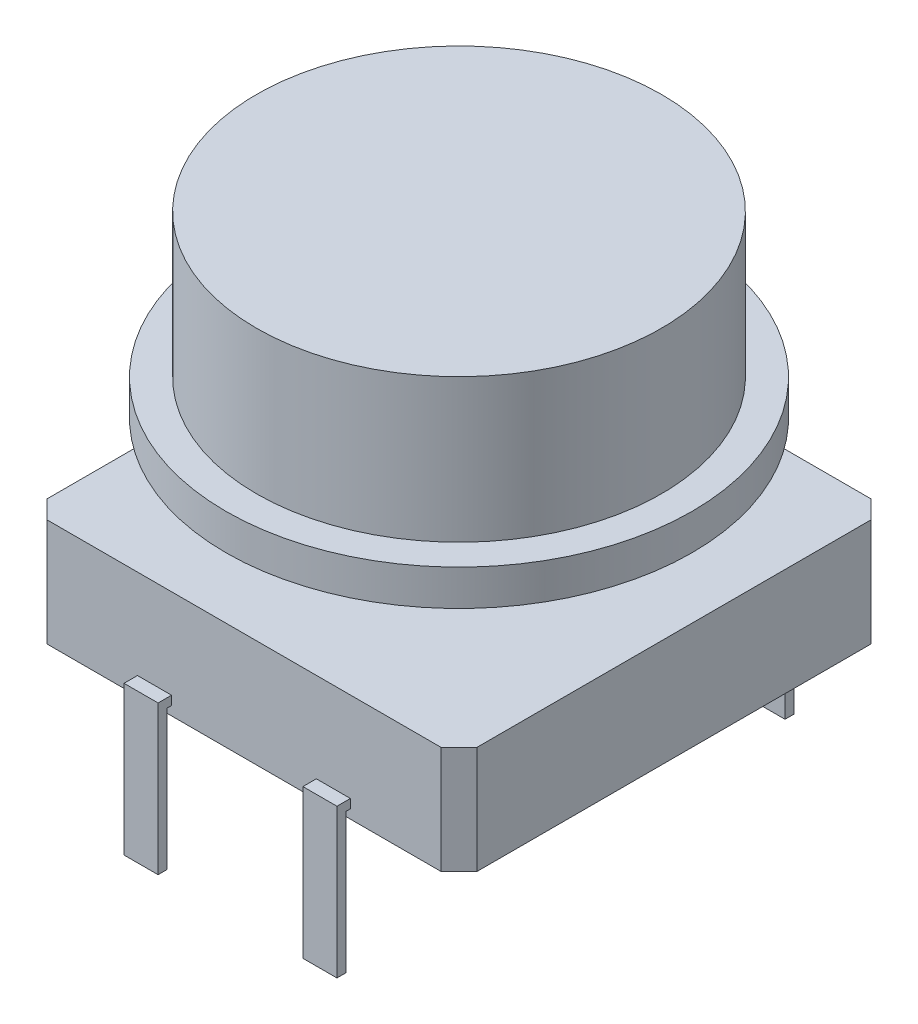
SolidWorks part; units mm, degrees
other "Markup1"
sketch "Sketch13" plane through (-6.5, 10.2, -6.5) normal (-0.9979, 0.0018, -0.0647) x (-0.0647, 0.0089, 0.9979)
ref_plane "Front Plane" through (0, 0, 0) normal (0, 0, 1) x (1, 0, 0)
ref_plane "Top Plane" through (0, 0, 0) normal (0, 1, 0) x (1, 0, 0)
ref_plane "Right Plane" through (0, 0, 0) normal (1, 0, 0) x (0, 0, -1)
sketch "Sketch1" plane through (0, 0, 0) normal (0, 1, 0) x (1, 0, 0)
  line L0 (-5.5, 6) -> (-6, 5.5)
  line L1 (-5.5, 6) -> (5.5, 6)
  line L2 (-6, 5.5) -> (-6, -5.5)
  line L3 (-5.5, -6) -> (5.5, -6)
  line L4 (6, 5.5) -> (6, -5.5)
  line L5 (-6, 6) -> (6, -6) construction
  line L6 (-6, -6) -> (6, 6) construction
  line L7 (5.5, 6) -> (6, 5.5)
  line L8 (5.5, -6) -> (6, -5.5)
  line L9 (-6, -5.5) -> (-5.5, -6)
  point P0 (0, 0)
  dimension "D1" = 12
  dimension "D2" = 12
extrude "Boss-Extrude1" add sketch "Sketch1" along normal blind 3
sketch "Sketch2" plane through (0, 3, 0) normal (0, 1, 0) x (1, 0, 0)
  circle A0 centre (0, 0) radius 3.375
  dimension "D1" = 6.75
extrude "Boss-Extrude2" add sketch "Sketch2" along normal blind 0.2
sketch "Sketch3" plane through (0, 3.2, 0) normal (0, 1, 0) x (1, 0, 0)
  line L1 (-1.75, 1.75) -> (1.75, 1.75)
  line L2 (-1.75, 1.75) -> (-1.75, -1.75)
  line L3 (-1.75, -1.75) -> (1.75, -1.75)
  line L4 (1.75, 1.75) -> (1.75, -1.75)
  line L5 (-1.75, 1.75) -> (1.75, -1.75) construction
  line L6 (-1.75, -1.75) -> (1.75, 1.75) construction
  point P0 (0, 0)
  dimension "D1" = 3.5
  dimension "D2" = 3.5
extrude "Boss-Extrude3" add sketch "Sketch3" along normal blind 2
sketch "Sketch4" plane through (0, 5.2, 0) normal (0, 1, 0) x (1, 0, 0)
  circle A0 centre (0, 0) radius 6.5
  dimension "D1" = 13
extrude "Boss-Extrude4" add sketch "Sketch4" along normal blind 1
sketch "Sketch5" plane through (0, 6.2, 0) normal (0, 1, 0) x (1, 0, 0)
  circle A0 centre (0, 0) radius 5.65
  dimension "D1" = 11.3
extrude "Boss-Extrude5" add sketch "Sketch5" along normal blind 4
ref_plane "Plane1" through (-2.97, 0, 0) normal (-1, 0, 0) x (0, 0, 1)
sketch "Sketch7" plane through (-2.97, 0, 0) normal (-1, 0, 0) x (0, 0, 1)
  line L1 (6, 3) -> (6, 0) construction
  line L7 (6.375, 0.5) -> (6, 0.5)
  line L9 (-5.5, 3) -> (5.5, 3) construction
  line L17 (0, -2.34) -> (0, 11.1182) construction
  line L18 (6, 0.5) -> (6, 0.25)
  line L23 (6.1875, 0.5) -> (6.1875, -2.75) construction
  line L24 (6, 0.25) -> (6.125, 0.25)
  line L28 (6.125, 0.25) -> (6.125, -3.65)
  line L29 (6.375, 0.5) -> (6.375, -3.65)
  line L30 (6.375, -3.65) -> (6.125, -3.65)
  dimension "D1" = 2.5
  dimension "D2" = 0.375
  dimension "D6" = 0.25
extrude "Boss-Extrude6" add sketch "Sketch7" against normal blind 0.95
ref_plane "Plane2" through (0, 0, 0) normal (-1, 0, 0) x (0, 0, 1)
mirror "Mirror1" about plane through (0, 0, 0) normal (-1, 0, 0) of "Boss-Extrude6"
ref_plane "Plane3" through (0, 0, 0) normal (0, 0, 1) x (1, 0, 0)
mirror "Mirror2" about plane through (0, 0, 0) normal (0, 0, 1) of "Mirror1", "Boss-Extrude6"
